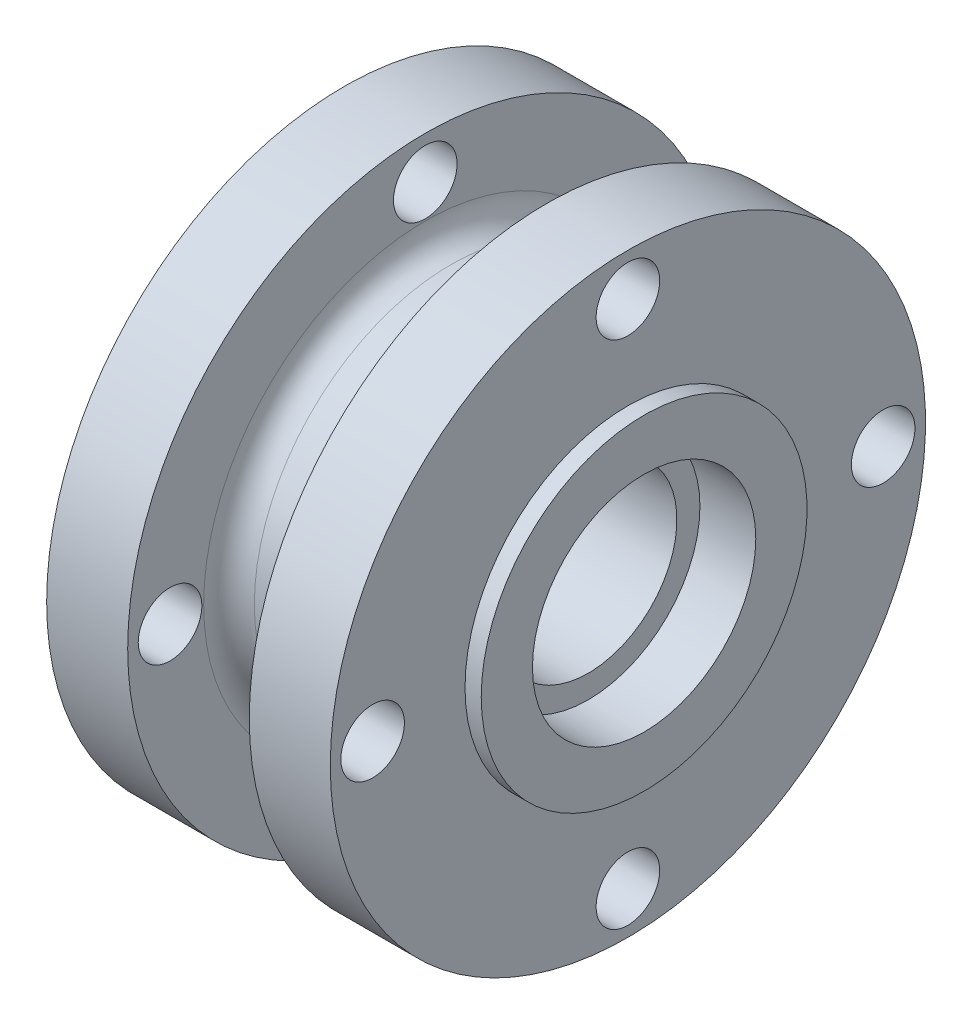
SolidWorks part; units mm, degrees
ref_plane "Front Plane" through (0, 0, 0) normal (0, 0, 1) x (1, 0, 0)
ref_plane "Top Plane" through (0, 0, 0) normal (0, 1, 0) x (1, 0, 0)
ref_plane "Right Plane" through (0, 0, 0) normal (1, 0, 0) x (0, 0, -1)
sketch "Sketch1" plane through (0, 0, 0) normal (0, 0, 1) x (1, 0, 0)
  line L0 (0, 0) -> (64.654, 0) construction
  line L1 (0, 14) -> (7, 14)
  line L2 (7, 14) -> (7, 11.1125)
  line L3 (7, 11.1125) -> (32.624, 11.1125)
  line L4 (32.624, 11.1125) -> (32.624, 14)
  line L5 (32.624, 14) -> (39.624, 14)
  line L6 (39.624, 14) -> (39.624, 20.4216)
  line L7 (39.624, 20.4216) -> (37.592, 20.4216)
  line L8 (37.592, 20.4216) -> (37.592, 37.3126)
  line L9 (37.592, 37.3126) -> (27.432, 37.3126)
  line L10 (2.032, 37.3126) -> (2.032, 20.4216)
  line L11 (2.032, 20.4216) -> (0, 20.4216)
  line L12 (0, 20.4216) -> (0, 14)
  line L13 (27.432, 24.6126) -> (27.432, 37.3126)
  line L14 (27.432, 24.6126) -> (12.192, 24.6126)
  line L15 (12.192, 24.6126) -> (12.192, 37.3126)
  line L16 (12.192, 37.3126) -> (2.032, 37.3126)
  dimension "D1" = 22.225
  dimension "D2" = 28
  dimension "D3" = 7
  dimension "D4" = 74.6252
  dimension "D5" = 40.8432
  dimension "D6" = 35.56
  dimension "D7" = 2.032
  dimension "D8" = 15.24
  dimension "D9" = 12.7
  dimension "D10" = 10.16
sketch "Sketch2" plane through (0, 0, 0) normal (0, 0, 1) x (1, 0, 0)
  line L0 (7, 11.1125) -> (32.624, 11.1125) construction
  line L1 (32.624, 11.1125) -> (32.624, 14) construction
  line L2 (32.624, 14) -> (39.624, 14) construction
  line L3 (39.624, 14) -> (39.624, 20.4216) construction
  line L4 (39.624, 20.4216) -> (37.592, 20.4216) construction
  line L5 (37.592, 20.4216) -> (37.592, 37.3126) construction
  line L7 (2.032, 37.3126) -> (2.032, 20.4216) construction
  line L8 (2.032, 20.4216) -> (0, 20.4216) construction
  line L9 (0, 20.4216) -> (0, 14) construction
  line L10 (0, 14) -> (7, 14) construction
  line L11 (7, 14) -> (7, 11.1125) construction
  line L12 (7, 11.1125) -> (32.624, 11.1125)
  line L13 (32.624, 11.1125) -> (32.624, 14)
  line L14 (32.624, 14) -> (39.624, 14)
  line L15 (39.624, 14) -> (39.624, 20.4216)
  line L16 (39.624, 20.4216) -> (37.592, 20.4216)
  line L17 (37.592, 20.4216) -> (37.592, 37.3126)
  line L18 (37.592, 37.3126) -> (27.432, 37.3126) construction
  line L19 (2.032, 37.3126) -> (2.032, 20.4216)
  line L20 (2.032, 20.4216) -> (0, 20.4216)
  line L21 (0, 20.4216) -> (0, 14)
  line L22 (0, 14) -> (7, 14)
  line L23 (7, 14) -> (7, 11.1125)
  line L24 (27.432, 24.6126) -> (27.432, 37.3126) construction
  line L25 (27.432, 24.6126) -> (12.192, 24.6126) construction
  line L26 (12.192, 24.6126) -> (12.192, 37.3126) construction
  line L27 (12.192, 37.3126) -> (2.032, 37.3126) construction
  line L28 (37.592, 37.3126) -> (27.432, 37.3126)
  line L29 (27.432, 24.6126) -> (27.432, 37.3126)
  line L30 (27.432, 24.6126) -> (12.192, 24.6126)
  line L31 (12.192, 24.6126) -> (12.192, 37.3126)
  line L32 (12.192, 37.3126) -> (2.032, 37.3126)
revolve "Revolve1" add sketch "Sketch2" angle 360 about L0
sketch "Sketch3" plane through (0, 0, 0) normal (1, 0, 0) x (0, 0, -1)
  circle A0 centre (0, 0) radius 32.004 construction
  circle A1 centre (0, 32.004) radius 3.9878
  circle A2 centre (-32.004, 0) radius 3.9878
  circle A3 centre (0, -32.004) radius 3.9878
  circle A4 centre (32.004, 0) radius 3.9878
  dimension "D1" = 64.008
  dimension "D2" = 7.9756
sketch "Sketch4" plane through (0, 0, 0) normal (1, 0, 0) x (0, 0, -1)
  circle A0 centre (0, 32.004) radius 3.9878 construction
  circle A1 centre (32.004, 0) radius 3.9878 construction
  circle A2 centre (-32.004, 0) radius 3.9878 construction
  circle A3 centre (0, -32.004) radius 3.9878 construction
  circle A4 centre (0, 32.004) radius 3.9878
  circle A5 centre (32.004, 0) radius 3.9878
  circle A6 centre (-32.004, 0) radius 3.9878
  circle A7 centre (0, -32.004) radius 3.9878
extrude "Cut-Extrude1" cut sketch "Sketch4" along normal blind 25.4 from offset 17.78
sketch "Sketch6" plane through (0, 0, 0) normal (1, 0, 0) x (0, 0, -1)
  circle A0 centre (0, -32.004) radius 3.9878 construction
  circle A1 centre (0, 32.004) radius 3.9878 construction
  circle A2 centre (-32.004, 0) radius 3.9878 construction
  circle A3 centre (32.004, 0) radius 3.9878 construction
  circle A4 centre (0, -32.004) radius 3.9878
  circle A5 centre (0, 32.004) radius 3.9878
  circle A6 centre (-32.004, 0) radius 3.9878
  circle A7 centre (32.004, 0) radius 3.9878
extrude "Cut-Extrude2" cut sketch "Sketch6" along normal blind 12.7
fillet "Fillet1" radius 3.175 2 edges at (27.432, 0, 24.6126) (12.192, 0, 24.6126)
